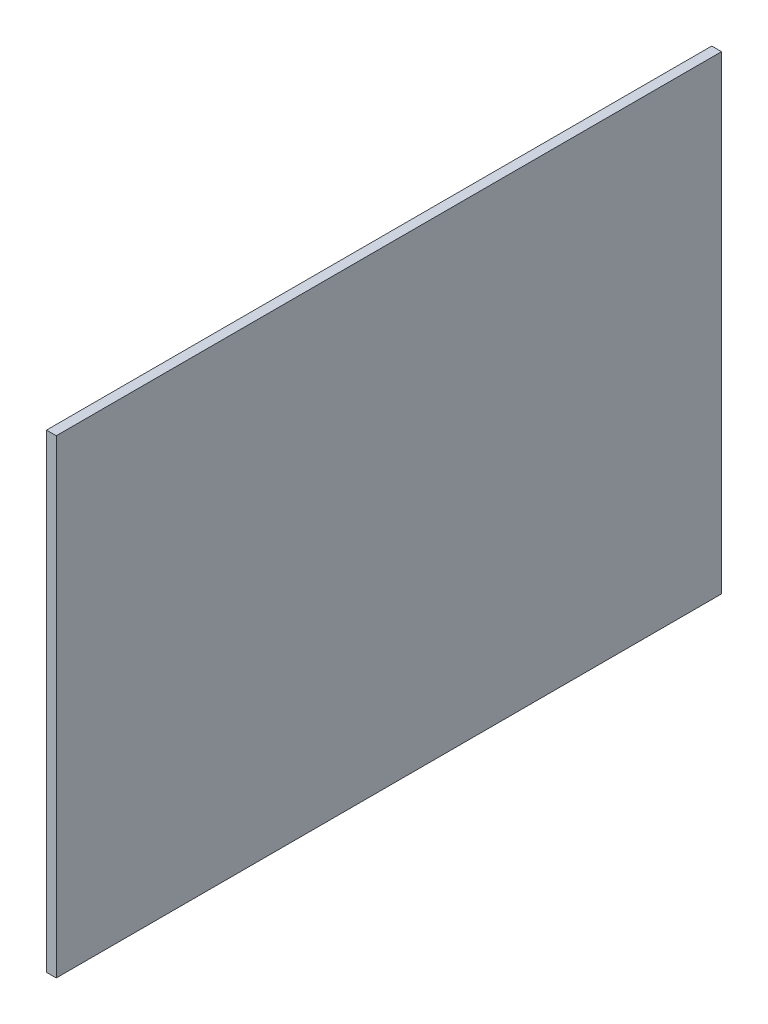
SolidWorks part; units mm, degrees
ref_plane "Front Plane" through (0, 0, 0) normal (0, 0, 1) x (1, 0, 0)
ref_plane "Top Plane" through (0, 0, 0) normal (0, 1, 0) x (1, 0, 0)
ref_plane "Right Plane" through (0, 0, 0) normal (1, 0, 0) x (0, 0, -1)
sketch "Sketch1" plane through (0, 0, 0) normal (0, 0, 1) x (1, 0, 0)
  line L0 (0, -152.4) -> (0, 152.4)
  line L1 (0, 152.4) -> (6.35, 152.4)
  line L2 (6.35, 152.4) -> (6.35, -152.4)
  line L3 (0, 0) -> (39.643, 0) construction
  line L4 (0, -152.4) -> (6.35, -152.4)
  point P7 (6.35, 0)
  dimension "D1" = 6.35
  dimension "D2" = 152.4
extrude "Extrude1" add sketch "Sketch1" along normal mid plane 431.8
